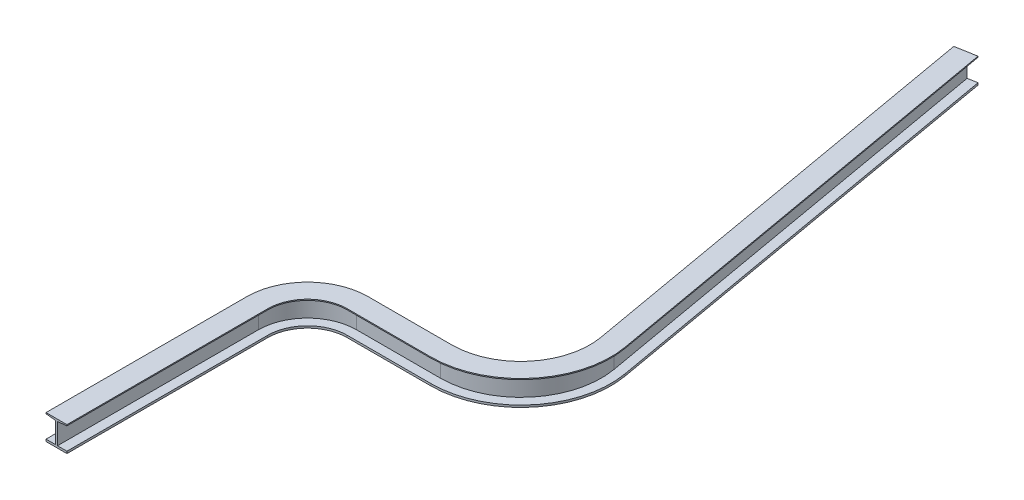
SolidWorks part; units mm, degrees
ref_plane "Front Plane" through (0, 0, 0) normal (0, 0, 1) x (1, 0, 0)
ref_plane "Top Plane" through (0, 0, 0) normal (0, 1, 0) x (1, 0, 0)
ref_plane "Right Plane" through (0, 0, 0) normal (1, 0, 0) x (0, 0, -1)
sketch "Sketch2" plane through (0, 0, 0) normal (0, 1, 0) x (1, 0, 0)
  line L1 (644.0341, 1045.2013) -> (414.6796, 2345.9354)
  line L2 (0, 0) -> (0, 609.6)
  line L5 (152.4, 762) -> (406.4, 762)
  arc A1 (644.0341, 1045.2013) -> (406.4, 762) centre (406.4, 1003.3) cw
  arc A4 (0, 609.6) -> (152.4, 762) centre (152.4, 609.6) cw
  dimension "D2" = 254
  dimension "D5" = 609.6
  dimension "D4" = 1320.8
  dimension "D1" = 152.4
  dimension "D3" = 241.3
  dimension "D6" = 80
sketch "Sketch6" plane through (0, 0, 0) normal (0, 0, 1) x (1, 0, 0)
  line L1 (-31.75, 50.8) -> (31.75, 50.8)
  line L2 (31.75, 50.8) -> (31.75, 47.625)
  line L3 (31.75, 47.625) -> (3.175, 44.45)
  line L4 (3.175, 44.45) -> (3.175, -19.05)
  line L7 (3.175, -19.05) -> (31.75, -19.05)
  line L13 (31.75, -19.05) -> (31.75, -25.4)
  line L15 (31.75, -25.4) -> (-31.75, -25.4)
  line L16 (-31.75, -25.4) -> (-31.75, -19.05)
  line L17 (-31.75, -19.05) -> (-3.175, -19.05)
  line L18 (-3.175, -19.05) -> (-3.175, 44.45)
  line L19 (-3.175, 44.45) -> (-31.75, 47.625)
  line L20 (-31.75, 47.625) -> (-31.75, 50.8)
  line L21 (0, 61.9276) -> (0, -61.6829) construction
  dimension "D2" = 50.8
  dimension "D3" = 76.2
  dimension "D4" = 3.175
  dimension "D5" = 6.35
  dimension "D7" = 3.175
  dimension "D8" = 6.35
  dimension "D9" = 63.5
  dimension "D10" = 31.75
  dimension "D11" = 44.45
sweep "Sweep1" add profiles "Sketch6" path "Sketch2"
